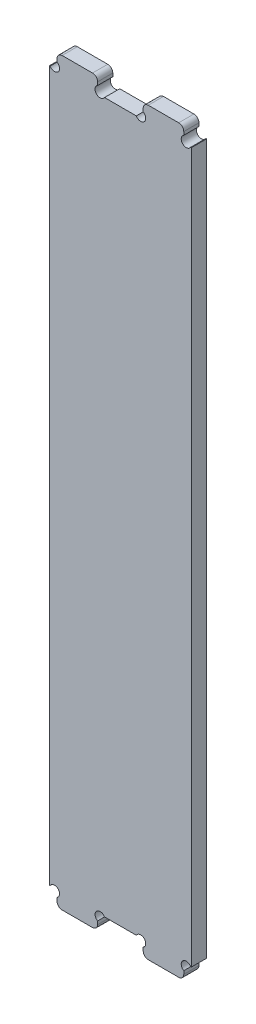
SolidWorks part; units mm, degrees
ref_plane "前视基准面" through (0, 0, 0) normal (0, 0, 1) x (1, 0, 0)
ref_plane "上视基准面" through (0, 0, 0) normal (0, 1, 0) x (1, 0, 0)
ref_plane "右视基准面" through (0, 0, 0) normal (1, 0, 0) x (0, 0, -1)
sketch "草图1" plane through (0, 0, 0) normal (0, 0, 1) x (1, 0, 0)
  line L1 (-14, -70) -> (14, -70)
  line L2 (-14, -70) -> (-14, 70)
  line L3 (-14, 70) -> (14, 70)
  line L4 (14, -70) -> (14, 70)
  line L5 (-14, -70) -> (14, 70) construction
  line L6 (-14, 70) -> (14, -70) construction
  point P0 (0, 0)
  dimension "D1" = 140
  dimension "D2" = 28
extrude "凸台-拉伸1" add sketch "草图1" along normal blind 3
sketch "草图2" plane through (0, 0, 3) normal (0, 0, 1) x (1, 0, 0)
  line L0 (0, 70) -> (0, -70) construction
  line L1 (14, 70) -> (-14, 70) construction
  line L2 (-14, -70) -> (14, -70) construction
  line L3 (-14, 0) -> (14, 0) construction
  line L4 (-12.5, 70) -> (-4.5, 70)
  line L5 (-12.5, 70) -> (-12.5, 73)
  line L6 (-12.5, 73) -> (-4.5, 73)
  line L7 (-4.5, 70) -> (-4.5, 73)
  line L8 (-14, 70) -> (-14, -70) construction
  line L9 (14, -70) -> (14, 70) construction
  line L10 (4.5, 70) -> (4.5, 73)
  line L11 (12.5, 73) -> (4.5, 73)
  line L12 (12.5, 70) -> (12.5, 73)
  line L13 (12.5, 70) -> (4.5, 70)
  line L14 (12.5, -70) -> (4.5, -70)
  line L15 (12.5, -70) -> (12.5, -73)
  line L16 (12.5, -73) -> (4.5, -73)
  line L17 (4.5, -70) -> (4.5, -73)
  line L18 (-4.5, -70) -> (-4.5, -73)
  line L19 (-12.5, -73) -> (-4.5, -73)
  line L20 (-12.5, -70) -> (-12.5, -73)
  line L21 (-12.5, -70) -> (-4.5, -70)
  dimension "D1" = 3
  dimension "D2" = 9
  dimension "D3" = 25
extrude "凸台-拉伸2" add sketch "草图2" against normal blind 3
hole_wizard "Ø2.0 (2) 直径孔1" positions "草图3" profile "草图4" hole size "Ø2.0" standard "GB"
sketch "草图3" plane through (0, 0, 3) normal (0, 0, 1) x (1, 0, 0)
  line L0 (4.5, 70) -> (-4.5, 70) construction
  line L1 (-4.5, 70) -> (-4.5, 73) construction
  line L2 (0, 70) -> (0, -70) construction
  line L3 (-4.5, -70) -> (4.5, -70) construction
  line L5 (-14, 0) -> (14, 0) construction
  line L6 (-14, 70) -> (-14, -70) construction
  line L7 (14, -70) -> (14, 70) construction
  line L9 (-8.5, 73) -> (-8.5, -73) construction
  line L10 (-4.5, 73) -> (-12.5, 73) construction
  line L11 (-12.5, -73) -> (-4.5, -73) construction
  point P0 (-4, 70.5)
  point P29 (-13, 70.5)
  point P30 (13, 70.5)
  point P31 (4, 70.5)
  point P32 (4, -70.5)
  point P33 (13, -70.5)
  point P34 (-13, -70.5)
  point P35 (-4, -70.5)
  dimension "D1" = 0.5
  dimension "D2" = 0.5
sketch "草图4" plane through (-4, 70.5, 3) normal (1, 0, 0) x (0, -1, 0)
  line L0 (0, 0) -> (0, 3)
  line L1 (0, 3) -> (1, 3)
  line L2 (1, 3) -> (1, 0)
  line L5 (1, 0) -> (0, 0)
  line L11 (0, -6.35) -> (0, 107.95) construction
  dimension "通孔孔直径" = 2
  dimension "通孔孔深度" = 3
fillet "圆角1" radius 1 8 edges at (12.5, -73, 1.5) (4.5, -73, 1.5) (-4.5, -73, 1.5) (-12.5, -73, 1.5) (12.5, 73, 1.5) (4.5, 73, 1.5) (-12.5, 73, 1.5) (-4.5, 73, 1.5)
